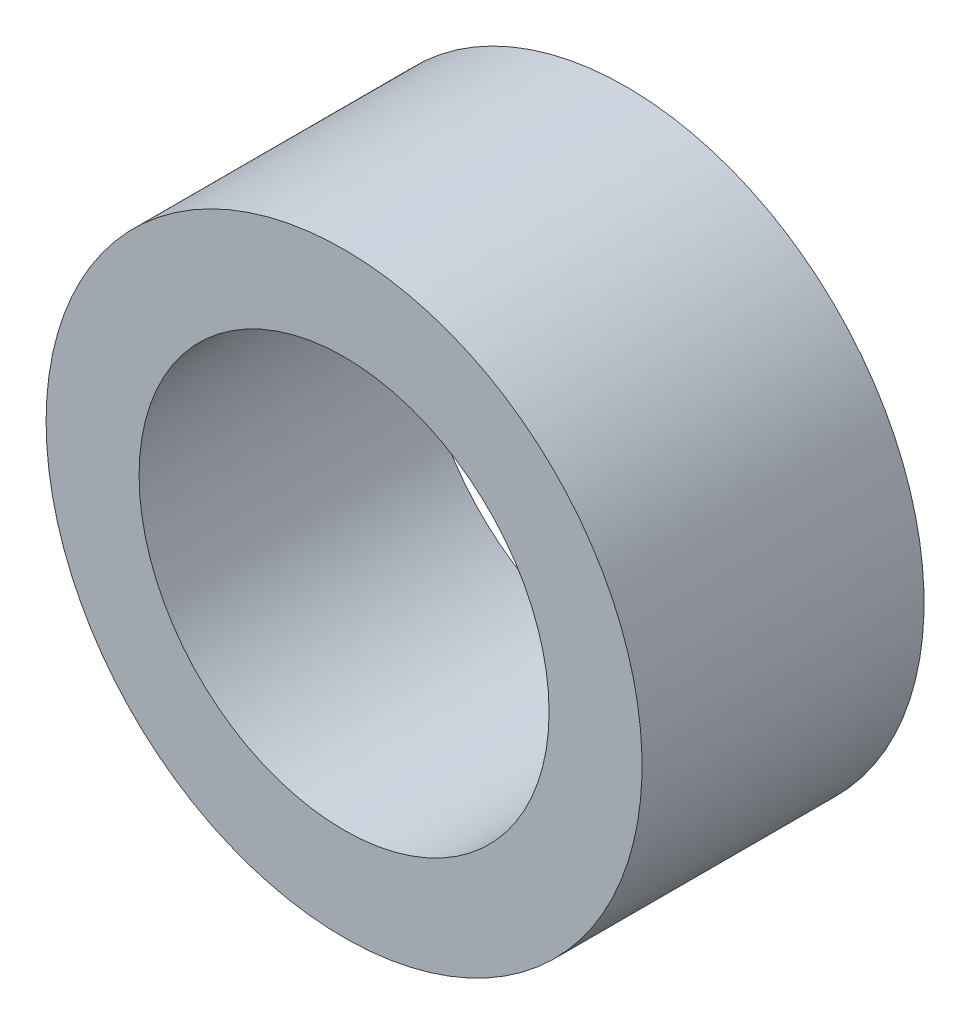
SolidWorks part; units mm, degrees
ref_plane "Front Plane" through (0, 0, 0) normal (0, 0, 1) x (1, 0, 0)
ref_plane "Top Plane" through (0, 0, 0) normal (0, 1, 0) x (1, 0, 0)
ref_plane "Right Plane" through (0, 0, 0) normal (1, 0, 0) x (0, 0, -1)
sketch "Sketch2" plane through (0, 0, 0) normal (0, 1, 0) x (-1, 0, 0)
  line L0 (0, 0) -> (0, 377.4141) construction
  line L1 (-182.8771, -0.753) -> (-265.8181, -0.753)
  line L2 (-182.8771, -0.753) -> (-182.8771, 250.8379)
  line L3 (-182.8771, 250.8379) -> (-265.8181, 250.8379)
  line L4 (-265.8181, -0.753) -> (-265.8181, 250.8379)
revolve "Revolve1" add sketch "Sketch2" angle 360 about L0
